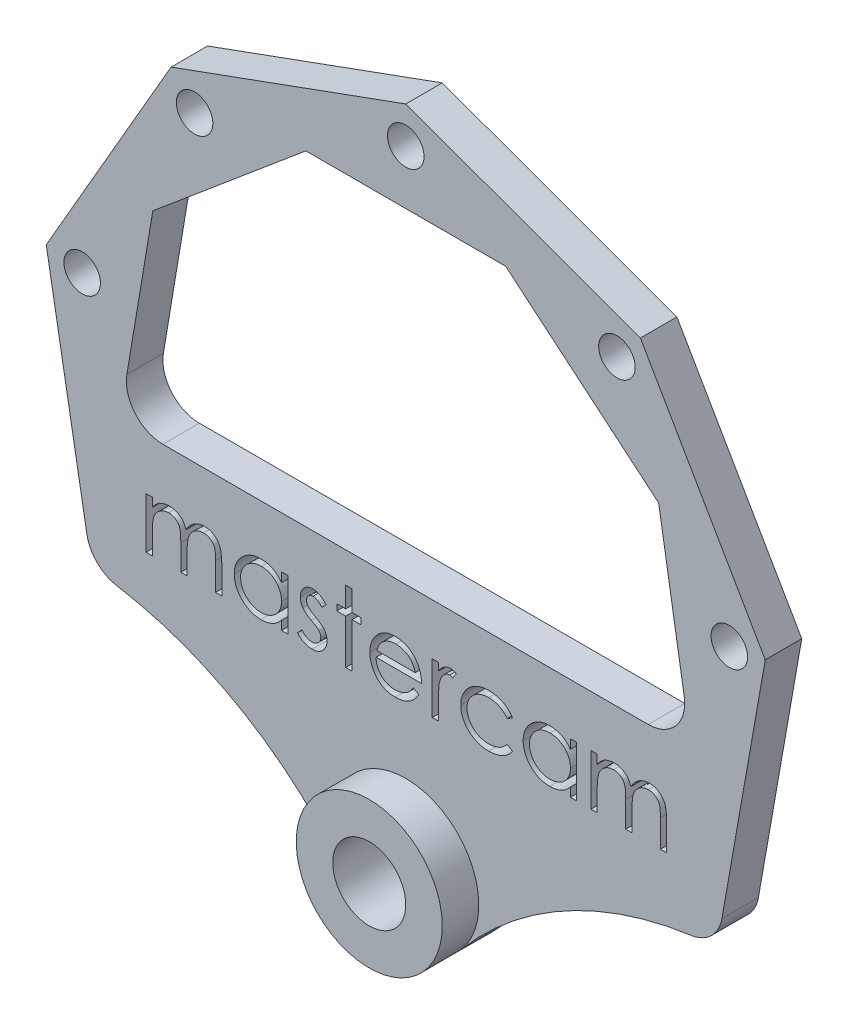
SolidWorks part; units mm, degrees
ref_plane "Plan de face" through (0, 0, 0) normal (0, 0, 1) x (1, 0, 0)
ref_plane "Plan de dessus" through (0, 0, 0) normal (0, 1, 0) x (1, 0, 0)
ref_plane "Plan de droite" through (0, 0, 0) normal (1, 0, 0) x (0, 0, -1)
sketch "Esquisse1" plane through (0, 0, 0) normal (0, 0, 1) x (1, 0, 0)
  line L0 (-148.3946, 0) -> (144.7359, 0) construction
  line L1 (0, 131.5756) -> (0, -138.2377) construction
  line L2 (-27.3616, 75.1754) -> (27.3616, 75.1754)
  line L3 (27.3616, 75.1754) -> (69.282, 40)
  line L4 (69.282, 40) -> (76.278, -2.3709)
  line L5 (86.6025, -50) -> (98.4808, 17.3648)
  line L6 (0, 100) -> (-64.2788, 76.6044)
  line L7 (-64.2788, 76.6044) -> (-98.4808, 17.3648)
  line L8 (-98.4808, 17.3648) -> (-87.3539, -45.7387)
  line L9 (66.4116, -14) -> (-66.5295, -14)
  line L10 (-76.3915, -2.3442) -> (-69.282, 40)
  line L11 (-69.282, 40) -> (-27.3616, 75.1754)
  line L12 (98.4808, 17.3648) -> (64.2788, 76.6044)
  line L13 (64.2788, 76.6044) -> (0, 100)
  line L14 (0, -93.9693) -> (34.202, -93.9693)
  line L15 (-86.6025, -50) -> (-60.4023, -71.9846)
  line L16 (60.4023, -71.9846) -> (86.6025, -50)
  line L17 (0, 0) -> (-64.2788, 76.6044) construction
  line L18 (-27.3616, 75.1754) -> (0, 0) construction
  line L19 (0, 0) -> (27.3616, 75.1754) construction
  line L20 (0, 0) -> (-69.282, 40) construction
  line L21 (0, 0) -> (69.282, 40) construction
  line L22 (69.282, 40) -> (69.2103, 40.5551) construction
  circle A0 centre (0, 0) radius 100 construction
  arc A1 (-15.9372, -92.0833) -> (15.3086, -92.8704) centre (0, -80) ccw
  circle A2 centre (0, 0) radius 80 construction
  arc A3 (-87.3539, -45.7387) -> (-79.1529, -53.8656) centre (-77.5058, -44.0022) ccw
  arc A4 (-79.1529, -53.8656) -> (-15.9372, -92.0833) centre (-95.623, -152.5) cw
  arc A5 (15.3086, -92.8704) -> (78.1269, -58.1689) centre (91.8513, -157.2226) cw
  arc A6 (78.1269, -58.1689) -> (86.6025, -50) centre (76.7545, -48.2635) ccw
  circle A7 centre (0, -80) radius 10
  arc A8 (76.278, -2.3709) -> (66.4116, -14) centre (66.4116, -4) cw
  arc A9 (-66.5295, -14) -> (-76.3915, -2.3442) centre (-66.5295, -4) cw
  dimension "D1" = 200
  dimension "D2" = 160
  dimension "D3" = 10
  dimension "D4" = 10
  dimension "D5" = 100
  dimension "D6" = 100
  dimension "D7" = 20
  dimension "D11" = 10
  dimension "D8" = 20
  dimension "D9" = 20
  dimension "D10" = 14
  dimension "D12" = 60
  dimension "D13" = 60
extrude "Boss.-Extru.1" add sketch "Esquisse1" along normal blind 10
sketch "Esquisse2" plane through (0, 0, 10) normal (0, 0, 1) x (1, 0, 0)
  line L0 (0, 0) -> (0, 100)
  line L1 (0, 0) -> (-64.2788, 76.6044) construction
  line L2 (0, 0) -> (-32.1394, 88.3022) construction
  line L3 (0, 100) -> (-64.2788, 76.6044) construction
  line L4 (0, 0) -> (-98.4808, 17.3648) construction
  line L5 (0, 0) -> (64.2788, 76.6044) construction
  line L6 (0, 0) -> (98.4808, 17.3648) construction
  circle A0 centre (0, 0) radius 90 construction
  circle A1 centre (88.6327, 15.6283) radius 5
  circle A2 centre (57.8509, 68.944) radius 5
  circle A3 centre (0, 90) radius 5
  circle A4 centre (-57.8509, 68.944) radius 5
  circle A5 centre (-88.6327, 15.6283) radius 5
  dimension "D1" = 180
  dimension "D2" = 10
extrude "Enlèv. mat.-Extru.1" cut sketch "Esquisse2" against normal blind 10 contours A4 | A5 | A2 | A1 | A3
sketch "Esquisse3" plane through (0, 0, 10) normal (0, 0, 1) x (1, 0, 0)
  circle A0 centre (0, -80) radius 20
  circle A1 centre (0, -80) radius 10
extrude "Boss.-Extru.2" add sketch "Esquisse3" along normal blind 10
sketch "Esquisse6" plane through (0, 0, 10) normal (0, 0, 1) x (1, 0, 0)
  text T0 "mastercam" font "Century Gothic" height in points 72
extrude "Enlèv. mat.-Extru.3" cut sketch "Esquisse6" against normal blind 10
